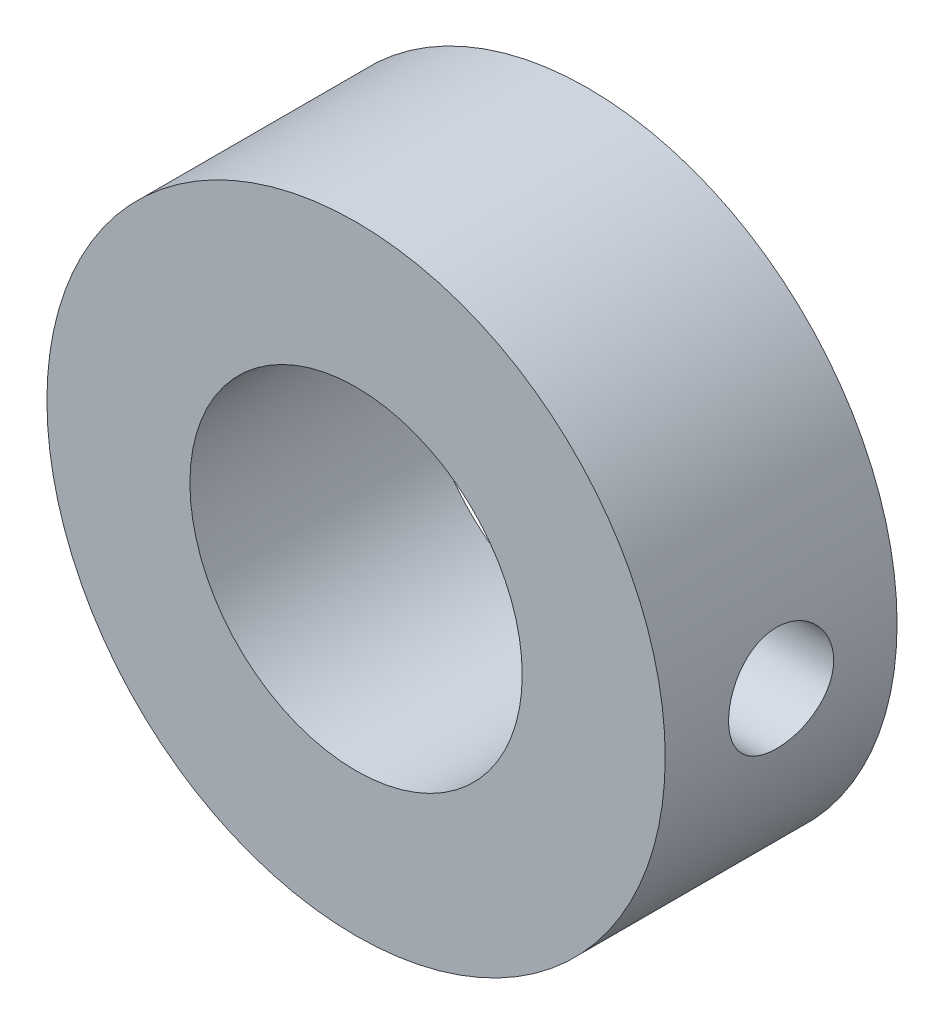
SolidWorks part; units mm, degrees
ref_plane "Plan de face" through (0, 0, 0) normal (0, 0, 1) x (1, 0, 0)
ref_plane "Plan de dessus" through (0, 0, 0) normal (0, 1, 0) x (1, 0, 0)
ref_plane "Plan de droite" through (0, 0, 0) normal (1, 0, 0) x (0, 0, -1)
sketch "Esquisse1" plane through (0, 0, 0) normal (0, 0, 1) x (1, 0, 0)
  circle A0 centre (0, 0) radius 10.75
  circle A1 centre (0, 0) radius 20
  dimension "D1" = 21.5
  dimension "D2" = 40
extrude "Extrusion1" add sketch "Esquisse1" along normal mid plane 15
hole_wizard "Trou taraudé M8x1.251" positions "Esquisse3D1" profile "Esquisse2" tap size "M8x1.25" standard "ISO"
sketch3d "Esquisse3D1"
  line L0 (0, 0, 0) -> (24.6382, 0, 0) construction
  point P0 (20, 0, 0)
sketch "Esquisse2" plane through (20, 0, 0) normal (0, 1, 0) x (0, 0, -1)
  line L0 (0, 0) -> (0, 9.25)
  line L1 (0, 9.25) -> (3.4, 9.25)
  line L2 (3.4, 9.25) -> (3.4, 0)
  line L5 (3.4, 0) -> (0, 0)
  line L11 (0, -6.35) -> (0, 107.95) construction
  dimension "Diamètre du trou pour taraudage jusqu'au prochain" = 6.8
  dimension "Profondeur du trou pour taraudage jusqu'au prochain" = 9.25
